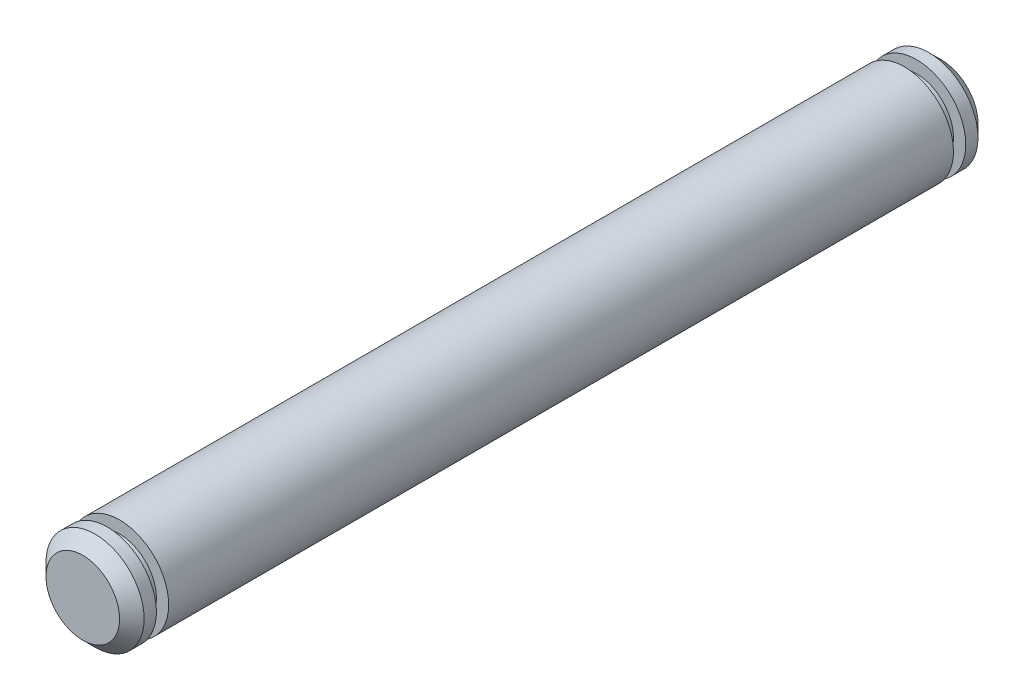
SolidWorks part; units mm, degrees
ref_plane "Plane1" through (0, 0, 0) normal (0, 0, 1) x (1, 0, 0)
ref_plane "Plane2" through (0, 0, 0) normal (0, 1, 0) x (1, 0, 0)
ref_plane "Plane3" through (0, 0, 0) normal (1, 0, 0) x (0, 0, -1)
sketch "Esquisse1" plane through (0, 0, 0) normal (0, 0, 1) x (1, 0, 0)
  circle A0 centre (0, 0) radius 4
  dimension "D1" = 8
extrude "Base-Extrusion" add sketch "Esquisse1" along normal blind 70
sketch "Esquisse2" plane through (0, 0, 0) normal (0, 1, 0) x (1, 0, 0)
  line L0 (-8, -2) -> (-3, -2)
  line L1 (-8, -2) -> (-8, -3)
  line L2 (-3, -3) -> (-8, -3)
  line L3 (-3, -3) -> (-3, -2)
  line L4 (4, 0) -> (-4, 0) construction
  line L5 (-4, 0) -> (-4, -70) construction
  line L6 (0, 3.3937) -> (0, -46.7356) construction
  line L7 (0, -120) -> (0, -20) construction
  dimension "D1" = 2
  dimension "D2" = 1
  dimension "D3" = 1
revolve "Enlever de la matière-Pivoter1" cut sketch "Esquisse2" angle 360 about L6
sketch "Esquisse3" plane through (0, 0, 0) normal (0, 1, 0) x (1, 0, 0)
  line L0 (-8, -67) -> (-3, -67)
  line L1 (-8, -67) -> (-8, -68)
  line L2 (-3, -68) -> (-8, -68)
  line L3 (-3, -68) -> (-3, -67)
  line L4 (4, -70) -> (-4, -70) construction
  line L5 (-4, -3) -> (-4, -70) construction
  line L6 (0, 3.5793) -> (0, -45.2503) construction
  line L7 (0, -120) -> (0, -20) construction
  dimension "D1" = 2
  dimension "D2" = 1
  dimension "D3" = 1
revolve "Enlever de la matière-Pivoter2" cut sketch "Esquisse3" angle 360 about L6
chamfer "Chanfrein1" distance 1 angle 45
